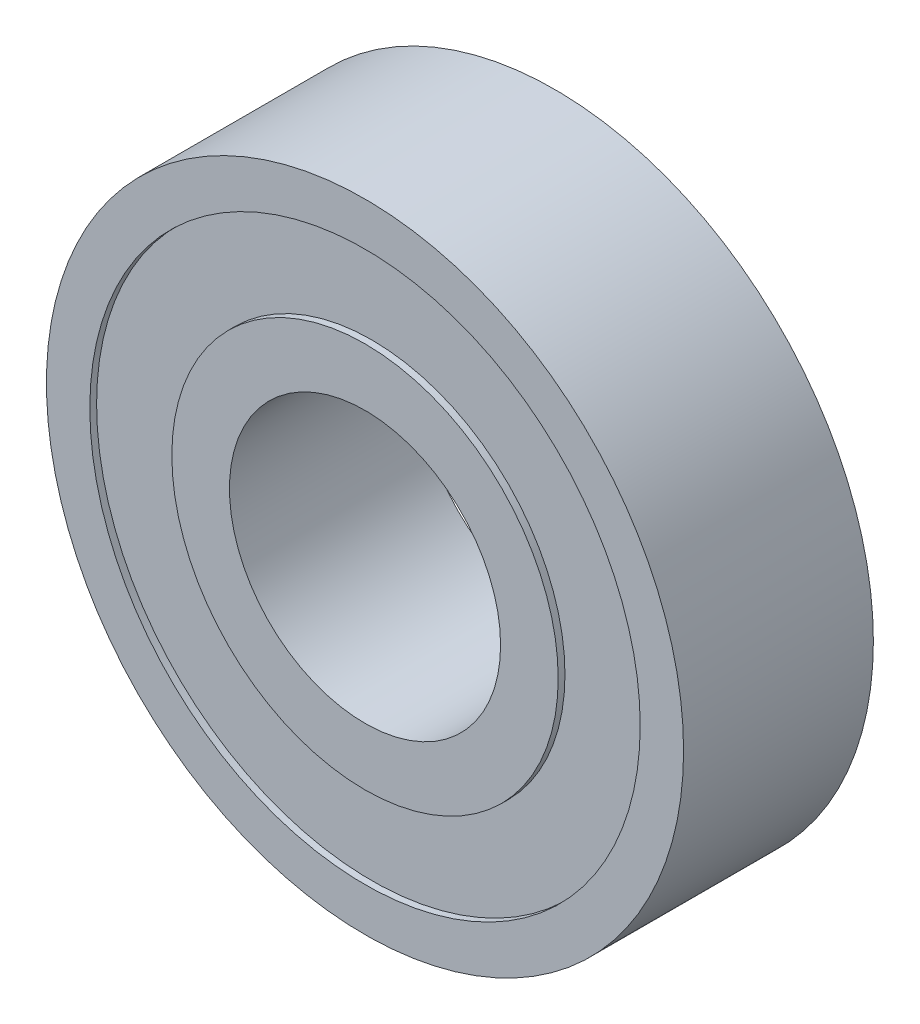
SolidWorks part; units mm, degrees
ref_plane "Plan de face" through (0, 0, 0) normal (0, 0, 1) x (1, 0, 0)
ref_plane "Plan de dessus" through (0, 0, 0) normal (0, 1, 0) x (1, 0, 0)
ref_plane "Plan de droite" through (0, 0, 0) normal (1, 0, 0) x (0, 0, -1)
sketch "Esquisse1" plane through (0, 0, 0) normal (0, 0, 1) x (1, 0, 0)
  circle A0 centre (0, 0) radius 23.5
  circle A1 centre (0, 0) radius 10
  dimension "D1" = 20
  dimension "D2" = 47
extrude "Extrusion1" add sketch "Esquisse1" along normal mid plane 14
sketch "Esquisse2" plane through (0, 0, 7) normal (0, 0, 1) x (1, 0, 0)
  circle A0 centre (0, 0) radius 14.25
  circle A1 centre (0, 0) radius 20.3
  dimension "D1" = 40.6
  dimension "D2" = 28.5
extrude "Enlèv. mat.-Extru.1" cut sketch "Esquisse2" against normal blind 0.5
mirror "Symétrie1" about plane through (0, 0, 0) normal (0, 0, 1) of "Enlèv. mat.-Extru.1"
